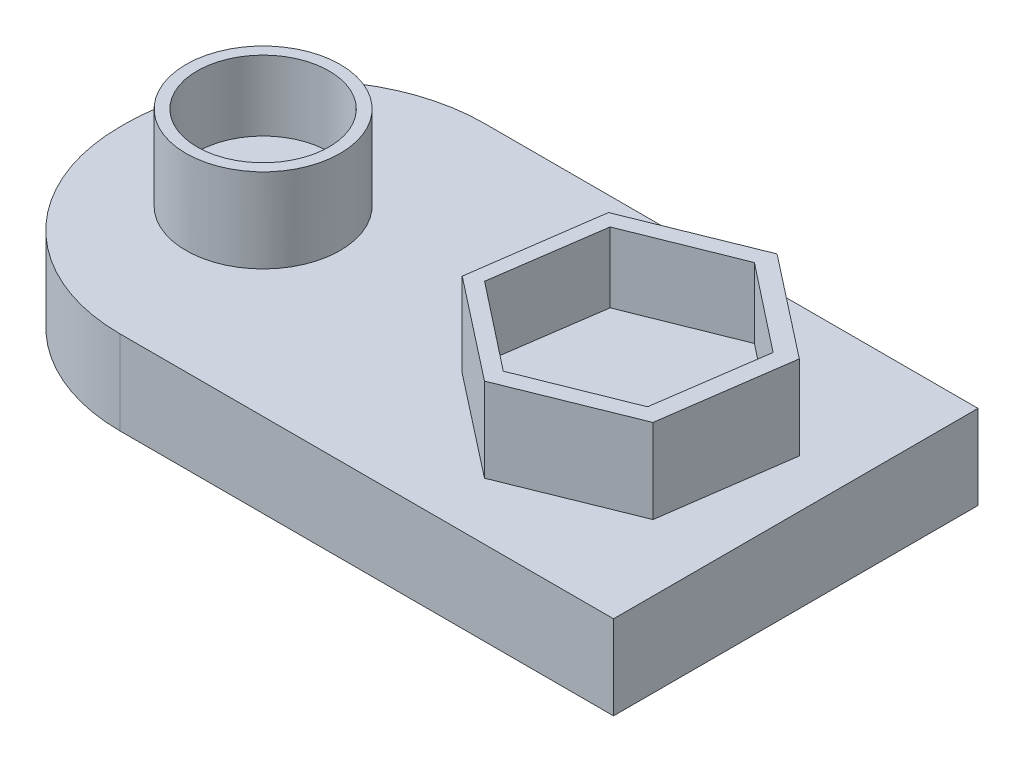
SolidWorks part; units mm, degrees
ref_plane "Plan1" through (0, 0, 0) normal (0, 0, 1) x (1, 0, 0)
ref_plane "Plan2" through (0, 0, 0) normal (0, 1, 0) x (1, 0, 0)
ref_plane "Plan3" through (0, 0, 0) normal (1, 0, 0) x (0, 0, -1)
sketch "Esquisse1" plane through (0, 0, 0) normal (0, 1, 0) x (1, 0, 0)
  line L1 (6.4, 0) -> (24, 0)
  line L2 (0, -6.4) -> (0, -6.6)
  line L3 (6.4, -13) -> (24, -13)
  line L4 (24, 0) -> (24, -13)
  arc A0 (0, -6.4) -> (6.4, 0) centre (6.4, -6.4) cw
  arc A1 (6.4, -13) -> (0, -6.6) centre (6.4, -6.6) cw
  point P7 (0, 0)
  dimension "D3" = 6.4
  dimension "D4" = 6.4
  dimension "D1" = 24
  dimension "D2" = 13
extrude "Base-Extrusion" add sketch "Esquisse1" along normal blind 3
sketch "Esquisse2" plane through (0, 3, 0) normal (0, 1, 0) x (-1, 0, 0)
  line L0 (-24, 0) -> (-6.4, 0) construction
  line L2 (-21.6385, 9.2307) -> (-22.2832, 4.6572)
  line L3 (-22.2832, 4.6572) -> (-18.6448, 1.812)
  line L4 (-18.6448, 1.812) -> (-14.3615, 3.5404)
  line L5 (-14.3615, 3.5404) -> (-13.7168, 8.114)
  line L6 (-13.7168, 8.114) -> (-17.3552, 10.9591)
  line L7 (-17.3552, 10.9591) -> (-21.6385, 9.2307)
  line L8 (-24, 13) -> (-24, 0) construction
  circle A0 centre (-5, 6.5) radius 2.75
  circle A2 centre (-18, 6.3856) radius 4 construction
  dimension "D1" = 5.5
  dimension "D2" = 6.5
  dimension "D3" = 8
  dimension "D4" = 13
  dimension "D5" = 6
extrude "Boss.-Extru.1" add sketch "Esquisse2" along normal blind 3
sketch "Esquisse3" plane through (0, 6, 0) normal (0, 1, 0) x (-1, 0, 0)
  circle A0 centre (-5, 6.5) radius 2.3523
extrude "Enlèv. mat.-Extru.1" cut sketch "Esquisse3" against normal blind 2.5
sketch "Esquisse4" plane through (0, 6, 0) normal (0, 1, 0) x (-1, 0, 0)
  line L1 (-21.0573, 8.8448) -> (-21.6188, 4.9278)
  line L2 (-21.6188, 4.9278) -> (-18.5075, 2.4831)
  line L3 (-18.5075, 2.4831) -> (-14.8345, 3.9552)
  line L4 (-14.8345, 3.9552) -> (-14.273, 7.8722)
  line L5 (-14.273, 7.8722) -> (-17.3844, 10.3169)
  line L6 (-17.3844, 10.3169) -> (-21.0573, 8.8448)
  circle A0 centre (-17.9459, 6.4) radius 3.4268 construction
extrude "Enlèv. mat.-Extru.2" cut sketch "Esquisse4" against normal blind 2.5
